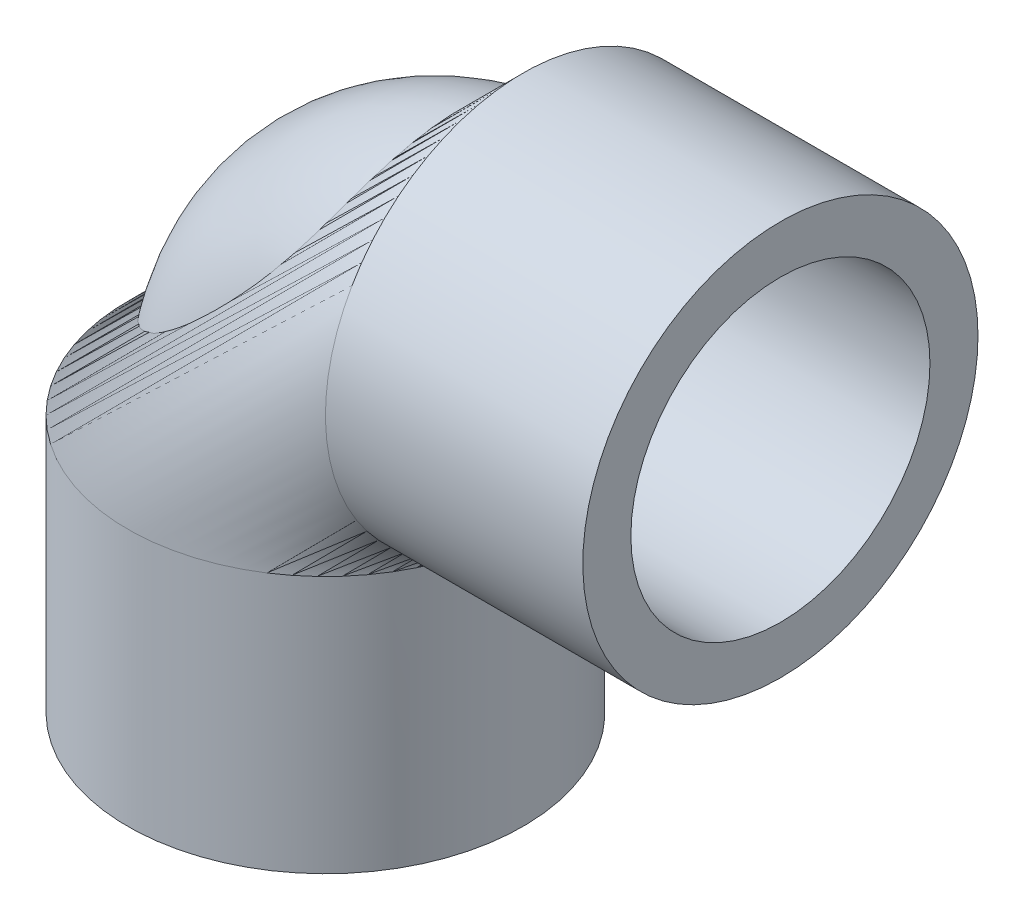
SolidWorks part; units mm, degrees
ref_plane "Front Plane" through (0, 0, 0) normal (0, 0, 1) x (1, 0, 0)
ref_plane "Top Plane" through (0, 0, 0) normal (0, 1, 0) x (1, 0, 0)
ref_plane "Right Plane" through (0, 0, 0) normal (1, 0, 0) x (0, 0, -1)
sketch "Sketch1" plane through (0, 0, 0) normal (0, 0, 1) x (1, 0, 0)
  line L0 (0, 13.843) -> (18.034, 13.843)
  line L1 (-13.843, -18.034) -> (-13.843, 0)
  arc A0 (-13.843, 0) -> (0, 13.843) centre (0, 0) cw
  point P6 (-9.7885, 9.7885)
  dimension "D1" = 13.843
  dimension "D2" = 18.034
  dimension "D3" = 18.034
sketch "Sketch8" plane through (0, 0, 0) normal (1, 0, 0) x (0, 0, -1)
  line L0 (0, 13.843) -> (0, 0) construction
  circle A0 centre (0, 13.843) radius 9.8425
  circle A1 centre (0, 13.843) radius 13.843
  dimension "D1" = 27.686
  dimension "D2" = 19.685
sweep "Sweep2" add profiles "Sketch8" path "Sketch1"
sketch "Sketch9" plane through (18.034, 0, 0) normal (1, 0, 0) x (0, 0, -1)
  circle A0 centre (0, 13.843) radius 10.4775
  dimension "D1" = 20.955
extrude "Cut-Extrude2" cut sketch "Sketch9" against normal blind 19.05
sketch "Sketch59" plane through (0, -18.034, 0) normal (0, -1, 0) x (1, 0, 0)
  circle A0 centre (-13.843, 0) radius 10.4775
  dimension "D1" = 20.955
extrude "Cut-Extrude3" cut sketch "Sketch59" against normal blind 19.05
ref_plane "Plane1" through (0, 27.686, 0) normal (0, 1, 0) x (1, 0, 0)
